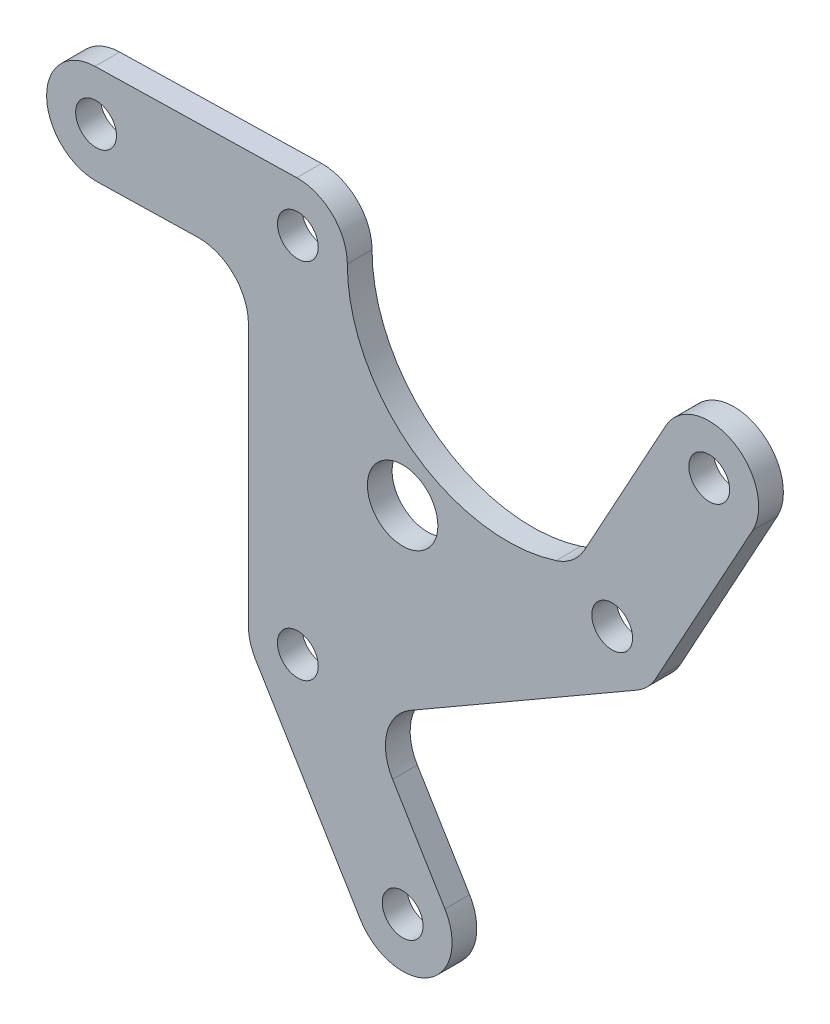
SolidWorks part; units mm, degrees
ref_plane "Спереди" through (0, 0, 0) normal (0, 0, 1) x (1, 0, 0)
ref_plane "Сверху" through (0, 0, 0) normal (0, 1, 0) x (1, 0, 0)
ref_plane "Справа" through (0, 0, 0) normal (1, 0, 0) x (0, 0, -1)
other "Configuration Table"
sketch "Эскиз1" plane through (0, 0, 0) normal (0, 0, 1) x (1, 0, 0)
  line L0 (-8.475, -14.6791) -> (16.95, 0) construction
  line L1 (16.95, 0) -> (-8.475, 14.6791) construction
  line L2 (-8.475, 14.6791) -> (-8.475, -14.6791) construction
  line L3 (-2.55, 0) -> (19.95, 0) construction
  line L4 (-11.0731, 16.1791) -> (19.5481, -1.5) construction
  line L5 (-8.475, -14.6791) -> (30.7512, -14.6791) construction
  circle A0 centre (0, 0) radius 16.95 construction
  circle A1 centre (0, 0) radius 2.55
  circle A2 centre (-8.475, 14.6791) radius 3
  circle A3 centre (16.95, 0) radius 3
  circle A4 centre (-8.475, -14.6791) radius 3
  dimension "D1" = 5.1
  dimension "D2" = 6
  dimension "D3" = 22.5
  dimension "D4" = 35.3583
  dimension "D5" = 30
  dimension "D6" = 90
sketch "Эскиз2" plane through (0, 0, 0) normal (0, 0, 1) x (1, 0, 0)
  line L0 (-12.475, 14.6791) -> (-12.475, -14.6791)
  line L1 (-6.475, -18.1432) -> (18.95, -3.4641)
  circle A2 centre (-8.475, 14.6791) radius 1.65
  circle A3 centre (16.95, 0) radius 1.65
  circle A4 centre (-8.475, -14.6791) radius 1.65
  arc A6 (-4.475, 14.6791) -> (-12.475, 14.6791) centre (-8.475, 14.6791) ccw
  circle A7 centre (0, 0) radius 2.85
  circle A8 centre (0, 0) radius 2.85
  arc A9 (-12.475, -14.6791) -> (-6.475, -18.1432) centre (-8.475, -14.6791) ccw
  arc A10 (18.95, -3.4641) -> (14.95, 3.4641) centre (16.95, 0) ccw
  arc A11 (-4.475, 14.6791) -> (14.95, 3.4641) centre (8.475, 14.6791) ccw
  circle A12 centre (0, 0) radius 16.95 construction
  point P1 (14.95, 3.4641)
  point P22 (-4.5783, 15.5823)
  point P23 (0, 0)
  dimension "D1" = 3.3
  dimension "D2" = 0.3
  dimension "D3" = 4
extrude "Бобышка-Вытянуть1" add sketch "Эскиз2" along normal blind 2
sketch "Эскиз3" plane through (0, 0, 0) normal (0, 0, 1) x (1, 0, 0)
  line L0 (-24.8, 14.3183) -> (0, -28.6366) construction
  line L1 (0, -28.6366) -> (24.8, 14.3183) construction
  line L2 (24.8, 14.3183) -> (-24.8, 14.3183) construction
  line L3 (-24.8, 14.3183) -> (-8.475, 14.6791) construction
  line L4 (-24.8884, 18.3173) -> (-8.5634, 18.6782)
  line L5 (-24.7116, 10.3193) -> (-8.3866, 10.6801)
  line L6 (24.8, 14.3183) -> (16.95, 0) construction
  line L7 (28.3075, 12.3953) -> (20.4575, -1.923)
  line L8 (21.2925, 16.2412) -> (13.4425, 1.923)
  line L9 (0, -28.6366) -> (-8.475, -14.6791) construction
  line L10 (-3.4191, -30.7126) -> (-11.8941, -16.7552)
  line L11 (3.4191, -26.5605) -> (-5.0559, -12.6031)
  circle A0 centre (0, 0) radius 28.6366 construction
  circle A1 centre (-24.8, 14.3183) radius 1.65
  circle A2 centre (24.8, 14.3183) radius 1.65
  circle A3 centre (0, -28.6366) radius 1.65
  arc A4 (-24.8884, 18.3173) -> (-24.7116, 10.3193) centre (-24.8, 14.3183) ccw
  arc A5 (-8.3866, 10.6801) -> (-8.5634, 18.6782) centre (-8.475, 14.6791) ccw
  arc A6 (28.3075, 12.3953) -> (21.2925, 16.2412) centre (24.8, 14.3183) ccw
  arc A7 (13.4425, 1.923) -> (20.4575, -1.923) centre (16.95, 0) ccw
  arc A8 (-3.4191, -30.7126) -> (3.4191, -26.5605) centre (0, -28.6366) ccw
  arc A9 (-5.0559, -12.6031) -> (-11.8941, -16.7552) centre (-8.475, -14.6791) ccw
  circle A11 centre (-8.475, -14.6791) radius 1.65 construction
  circle A12 centre (16.95, 0) radius 1.65 construction
  circle A13 centre (-8.475, 14.6791) radius 1.65 construction
  circle A14 centre (-8.475, -14.6791) radius 1.65
  circle A15 centre (16.95, 0) radius 1.65
  circle A16 centre (-8.475, 14.6791) radius 1.65
  point P7 (-16.6375, 14.4987)
  point P16 (20.875, 7.1591)
  point P23 (-4.2375, -21.6579)
  dimension "D1" = 3.3
  dimension "D3" = 4
  dimension "D2" = 49.6
extrude "Бобышка-Вытянуть2" add sketch "Эскиз3" along normal blind 2
fillet "Скругление1" radius 4 3 edges at (14.0201, 2.9764, 1) (-2.9335, -16.0985, 1) (-12.475, 10.5897, 1)
